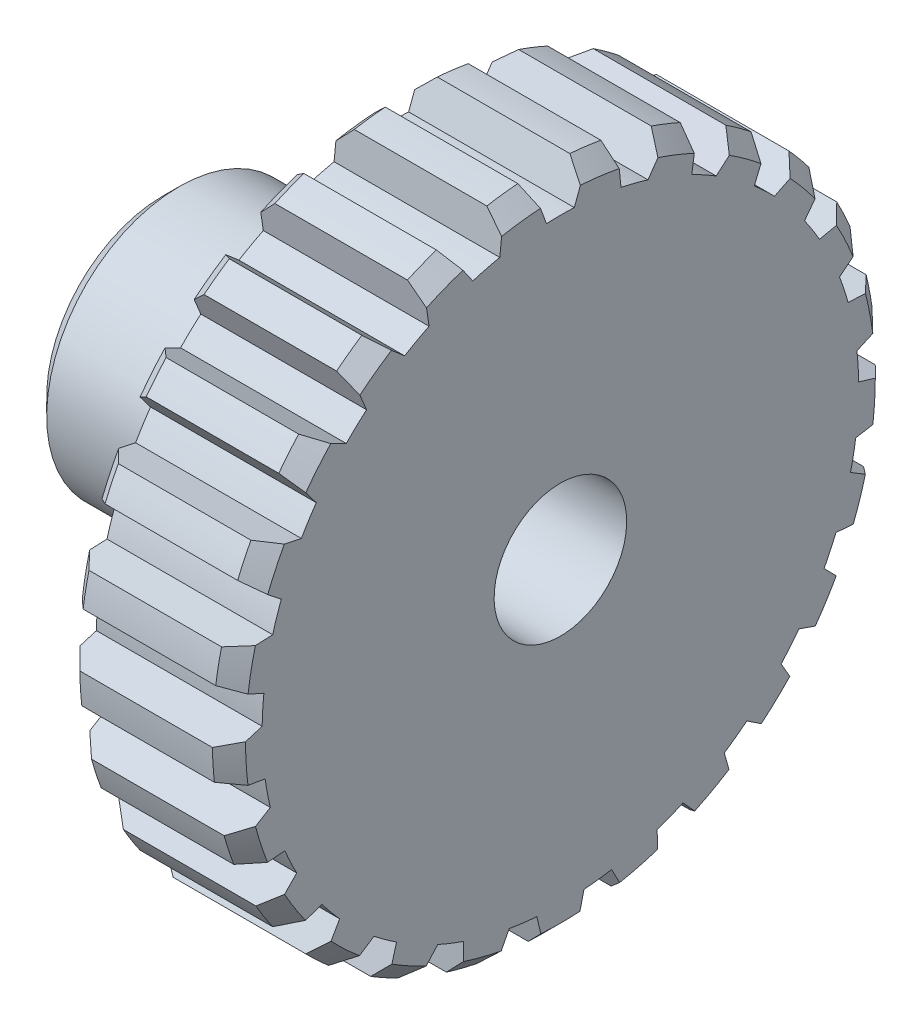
SolidWorks part; units mm, degrees
ref_plane "Front" through (0, 0, 0) normal (0, 0, 1) x (1, 0, 0)
ref_plane "Top" through (0, 0, 0) normal (0, 1, 0) x (1, 0, 0)
ref_plane "Right" through (0, 0, 0) normal (1, 0, 0) x (0, 0, -1)
sketch "Sketch1" plane through (0, 0, 0) normal (0, 0, 1) x (1, 0, 0)
  line L0 (0, 0) -> (-12, 0)
  line L1 (-12, 2) -> (-12, 4)
  line L2 (-12, 4) -> (-5, 4)
  line L3 (-5, 4) -> (-5, 10)
  line L4 (-5, 10) -> (0, 10)
  line L5 (0, 10) -> (0, 2)
  line L6 (0, 2) -> (-12, 2)
  dimension "D1" = 10
  dimension "D2" = 4
  dimension "D3" = 12
  dimension "D4" = 7
revolve "Revolve1" add sketch "Sketch1" angle 360 about L0
sketch "Sketch3" plane through (0, 0, 0) normal (1, 0, 0) x (0, 0, -1)
  line L0 (-0.785, 9.9691) -> (-0.42, 8.9902)
  line L1 (0.785, 9.9691) -> (0.785, 10.7794)
  line L2 (1.9204, 10.636) -> (1.7189, 9.8512)
  line L3 (-0.785, 10.7794) -> (-0.785, 9.9691)
  line L4 (1.7189, 9.8512) -> (1.829, 8.8122)
  line L5 (0.42, 8.9902) -> (0.785, 9.9691)
  line L6 (2.6426, 8.6033) -> (3.2396, 9.4607)
  line L7 (3.2396, 9.4607) -> (3.4411, 10.2455)
  line L8 (4.5051, 9.8243) -> (4.1148, 9.1142)
  line L9 (4.1148, 9.1142) -> (3.963, 8.0805)
  line L10 (4.6991, 7.6758) -> (5.4906, 8.3578)
  line L11 (5.4906, 8.3578) -> (5.8809, 9.0679)
  line L12 (6.8068, 8.3952) -> (6.2521, 7.8046)
  line L13 (6.2521, 7.8046) -> (5.848, 6.8411)
  line L14 (6.4604, 6.2661) -> (7.3966, 6.7298)
  line L15 (7.3966, 6.7298) -> (7.9513, 7.3205)
  line L16 (8.6807, 6.4387) -> (7.9966, 6.0045)
  line L17 (7.9966, 6.0045) -> (7.3656, 5.1718)
  line L18 (7.8157, 4.4626) -> (8.8378, 4.6789)
  line L19 (8.8378, 4.6789) -> (9.522, 5.1131)
  line L20 (10.0093, 4.0776) -> (9.2386, 3.8272)
  line L21 (9.2386, 3.8272) -> (8.4204, 3.1776)
  line L22 (8.68, 2.3787) -> (9.7238, 2.3341)
  line L23 (9.7238, 2.3341) -> (10.4944, 2.5844)
  line L24 (10.7089, 1.4603) -> (9.9002, 1.4094)
  line L25 (9.9002, 1.4094) -> (8.9461, 0.9837)
  line L26 (8.9988, 0.1453) -> (9.9988, -0.1575)
  line L27 (9.9988, -0.1575) -> (10.8074, -0.1066)
  line L28 (10.7356, -1.2488) -> (9.9397, -1.0969)
  line L29 (9.9397, -1.0969) -> (8.9097, -1.272)
  line L30 (8.7523, -2.0972) -> (9.6455, -2.6391)
  line L31 (9.6455, -2.6391) -> (10.4414, -2.791)
  line L32 (10.0878, -3.8794) -> (9.3546, -3.5344)
  line L33 (9.3546, -3.5344) -> (8.3134, -3.4478)
  line L34 (7.9557, -4.2079) -> (8.6861, -4.9549)
  line L35 (8.6861, -4.9549) -> (9.4193, -5.2999)
  line L36 (8.8061, -6.2662) -> (8.1817, -5.7497)
  line L37 (8.1817, -5.7497) -> (7.1948, -5.407)
  line L38 (6.6593, -6.0542) -> (7.181, -6.9594)
  line L39 (7.181, -6.9594) -> (7.8053, -7.4759)
  line L40 (6.9711, -8.2593) -> (6.4948, -7.6038)
  line L41 (6.4948, -7.6038) -> (5.6241, -7.0264)
  line L42 (4.9445, -7.5201) -> (5.2246, -8.5266)
  line L43 (5.2246, -8.5266) -> (5.7009, -9.1821)
  line L44 (4.698, -9.7335) -> (4.3998, -8.9801)
  line L45 (4.3998, -8.9801) -> (3.7, -8.2043)
  line L46 (2.919, -8.5135) -> (2.94, -9.5581)
  line L47 (2.94, -9.5581) -> (3.2383, -10.3114)
  line L48 (2.1298, -10.596) -> (2.0283, -9.7921)
  line L49 (2.0283, -9.7921) -> (1.5435, -8.8667)
  line L50 (0.7101, -8.9719) -> (0.4707, -9.9889)
  line L51 (0.4707, -9.9889) -> (0.5722, -10.7928)
  line L52 (-0.5722, -10.7928) -> (-0.4707, -9.9889)
  line L53 (-0.4707, -9.9889) -> (-0.7101, -8.9719)
  line L54 (-1.5435, -8.8667) -> (-2.0283, -9.7921)
  line L55 (-2.0283, -9.7921) -> (-2.1298, -10.596)
  line L56 (-3.2383, -10.3114) -> (-2.94, -9.5581)
  line L57 (-2.94, -9.5581) -> (-2.919, -8.5135)
  line L58 (-3.7, -8.2043) -> (-4.3998, -8.9801)
  line L59 (-4.3998, -8.9801) -> (-4.698, -9.7335)
  line L60 (-5.7009, -9.1821) -> (-5.2246, -8.5266)
  line L61 (-5.2246, -8.5266) -> (-4.9445, -7.5201)
  line L62 (-5.6241, -7.0264) -> (-6.4948, -7.6038)
  line L63 (-6.4948, -7.6038) -> (-6.9711, -8.2593)
  line L64 (-7.8053, -7.4759) -> (-7.181, -6.9594)
  line L65 (-7.181, -6.9594) -> (-6.6593, -6.0542)
  line L66 (-7.1948, -5.407) -> (-8.1817, -5.7497)
  line L67 (-8.1817, -5.7497) -> (-8.8061, -6.2662)
  line L68 (-9.4193, -5.2999) -> (-8.6861, -4.9549)
  line L69 (-8.6861, -4.9549) -> (-7.9557, -4.2079)
  line L70 (-8.3134, -3.4478) -> (-9.3546, -3.5344)
  line L71 (-9.3546, -3.5344) -> (-10.0878, -3.8794)
  line L72 (-10.4414, -2.791) -> (-9.6455, -2.6391)
  line L73 (-9.6455, -2.6391) -> (-8.7523, -2.0972)
  line L74 (-8.9097, -1.272) -> (-9.9397, -1.0969)
  line L75 (-9.9397, -1.0969) -> (-10.7356, -1.2488)
  line L76 (-10.8074, -0.1066) -> (-9.9988, -0.1575)
  line L77 (-9.9988, -0.1575) -> (-8.9988, 0.1453)
  line L78 (-8.9461, 0.9837) -> (-9.9002, 1.4094)
  line L79 (-9.9002, 1.4094) -> (-10.7089, 1.4603)
  line L80 (-10.4944, 2.5844) -> (-9.7238, 2.3341)
  line L81 (-9.7238, 2.3341) -> (-8.68, 2.3787)
  line L82 (-8.4204, 3.1776) -> (-9.2386, 3.8272)
  line L83 (-9.2386, 3.8272) -> (-10.0093, 4.0776)
  line L84 (-9.522, 5.1131) -> (-8.8378, 4.6789)
  line L85 (-8.8378, 4.6789) -> (-7.8157, 4.4626)
  line L86 (-7.3656, 5.1718) -> (-7.9966, 6.0045)
  line L87 (-7.9966, 6.0045) -> (-8.6807, 6.4387)
  line L88 (-7.9513, 7.3205) -> (-7.3966, 6.7298)
  line L89 (-7.3966, 6.7298) -> (-6.4604, 6.2661)
  line L90 (-5.848, 6.8411) -> (-6.2521, 7.8046)
  line L91 (-6.2521, 7.8046) -> (-6.8068, 8.3952)
  line L92 (-5.8809, 9.0679) -> (-5.4906, 8.3578)
  line L93 (-5.4906, 8.3578) -> (-4.6991, 7.6758)
  line L94 (-3.963, 8.0805) -> (-4.1148, 9.1142)
  line L95 (-4.1148, 9.1142) -> (-4.5051, 9.8243)
  line L96 (-3.4411, 10.2455) -> (-3.2396, 9.4607)
  line L97 (-3.2396, 9.4607) -> (-2.6426, 8.6033)
  line L98 (-1.829, 8.8122) -> (-1.7189, 9.8512)
  line L99 (-1.7189, 9.8512) -> (-1.9204, 10.636)
  arc A0 (3.4411, 10.2455) -> (1.9204, 10.636) centre (0, 0) ccw
  arc A1 (0.42, 8.9902) -> (-0.42, 8.9902) centre (0, 0) ccw
  arc A2 (0.785, 10.7794) -> (-0.785, 10.7794) centre (0, 0) ccw
  arc A3 (2.6426, 8.6033) -> (1.829, 8.8122) centre (0, 0) ccw
  arc A4 (5.8809, 9.0679) -> (4.5051, 9.8243) centre (0, 0) ccw
  arc A5 (4.6991, 7.6758) -> (3.963, 8.0805) centre (0, 0) ccw
  arc A6 (7.9513, 7.3205) -> (6.8068, 8.3952) centre (0, 0) ccw
  arc A7 (6.4604, 6.2661) -> (5.848, 6.8411) centre (0, 0) ccw
  arc A8 (9.522, 5.1131) -> (8.6807, 6.4387) centre (0, 0) ccw
  arc A9 (7.8157, 4.4626) -> (7.3656, 5.1718) centre (0, 0) ccw
  arc A10 (10.4944, 2.5844) -> (10.0093, 4.0776) centre (0, 0) ccw
  arc A11 (8.68, 2.3787) -> (8.4204, 3.1776) centre (0, 0) ccw
  arc A12 (10.8074, -0.1066) -> (10.7089, 1.4603) centre (0, 0) ccw
  arc A13 (8.9988, 0.1453) -> (8.9461, 0.9837) centre (0, 0) ccw
  arc A14 (10.4414, -2.791) -> (10.7356, -1.2488) centre (0, 0) ccw
  arc A15 (8.7523, -2.0972) -> (8.9097, -1.272) centre (0, 0) ccw
  arc A16 (9.4193, -5.2999) -> (10.0878, -3.8794) centre (0, 0) ccw
  arc A17 (7.9557, -4.2079) -> (8.3134, -3.4478) centre (0, 0) ccw
  arc A18 (7.8053, -7.4759) -> (8.8061, -6.2662) centre (0, 0) ccw
  arc A19 (6.6593, -6.0542) -> (7.1948, -5.407) centre (0, 0) ccw
  arc A20 (5.7009, -9.1821) -> (6.9711, -8.2593) centre (0, 0) ccw
  arc A21 (4.9445, -7.5201) -> (5.6241, -7.0264) centre (0, 0) ccw
  arc A22 (3.2383, -10.3114) -> (4.698, -9.7335) centre (0, 0) ccw
  arc A23 (2.919, -8.5135) -> (3.7, -8.2043) centre (0, 0) ccw
  arc A24 (0.5722, -10.7928) -> (2.1298, -10.596) centre (0, 0) ccw
  arc A25 (0.7101, -8.9719) -> (1.5435, -8.8667) centre (0, 0) ccw
  arc A26 (-2.1298, -10.596) -> (-0.5722, -10.7928) centre (0, 0) ccw
  arc A27 (-1.5435, -8.8667) -> (-0.7101, -8.9719) centre (0, 0) ccw
  arc A28 (-4.698, -9.7335) -> (-3.2383, -10.3114) centre (0, 0) ccw
  arc A29 (-3.7, -8.2043) -> (-2.919, -8.5135) centre (0, 0) ccw
  arc A30 (-6.9711, -8.2593) -> (-5.7009, -9.1821) centre (0, 0) ccw
  arc A31 (-5.6241, -7.0264) -> (-4.9445, -7.5201) centre (0, 0) ccw
  arc A32 (-8.8061, -6.2662) -> (-7.8053, -7.4759) centre (0, 0) ccw
  arc A33 (-7.1948, -5.407) -> (-6.6593, -6.0542) centre (0, 0) ccw
  arc A34 (-10.0878, -3.8794) -> (-9.4193, -5.2999) centre (0, 0) ccw
  arc A35 (-8.3134, -3.4478) -> (-7.9557, -4.2079) centre (0, 0) ccw
  arc A36 (-10.7356, -1.2488) -> (-10.4414, -2.791) centre (0, 0) ccw
  arc A37 (-8.9097, -1.272) -> (-8.7523, -2.0972) centre (0, 0) ccw
  arc A38 (-10.7089, 1.4603) -> (-10.8074, -0.1066) centre (0, 0) ccw
  arc A39 (-8.9461, 0.9837) -> (-8.9988, 0.1453) centre (0, 0) ccw
  arc A40 (-10.0093, 4.0776) -> (-10.4944, 2.5844) centre (0, 0) ccw
  arc A41 (-8.4204, 3.1776) -> (-8.68, 2.3787) centre (0, 0) ccw
  arc A42 (-8.6807, 6.4387) -> (-9.522, 5.1131) centre (0, 0) ccw
  arc A43 (-7.3656, 5.1718) -> (-7.8157, 4.4626) centre (0, 0) ccw
  arc A44 (-6.8068, 8.3952) -> (-7.9513, 7.3205) centre (0, 0) ccw
  arc A45 (-5.848, 6.8411) -> (-6.4604, 6.2661) centre (0, 0) ccw
  arc A46 (-4.5051, 9.8243) -> (-5.8809, 9.0679) centre (0, 0) ccw
  arc A47 (-3.963, 8.0805) -> (-4.6991, 7.6758) centre (0, 0) ccw
  arc A48 (-1.9204, 10.636) -> (-3.4411, 10.2455) centre (0, 0) ccw
  arc A49 (-1.829, 8.8122) -> (-2.6426, 8.6033) centre (0, 0) ccw
chamfer "Chamfer4" distance 0.5 angle 45 3 edges at (0, 10, 0) (-5, 10, 0) (-12, 4, 0)
extrude "Cut-Extrude2" cut sketch "Sketch3" against normal blind 10
scale "Scale3" scale about centroid uniform scaling yes scale factor 0.85
